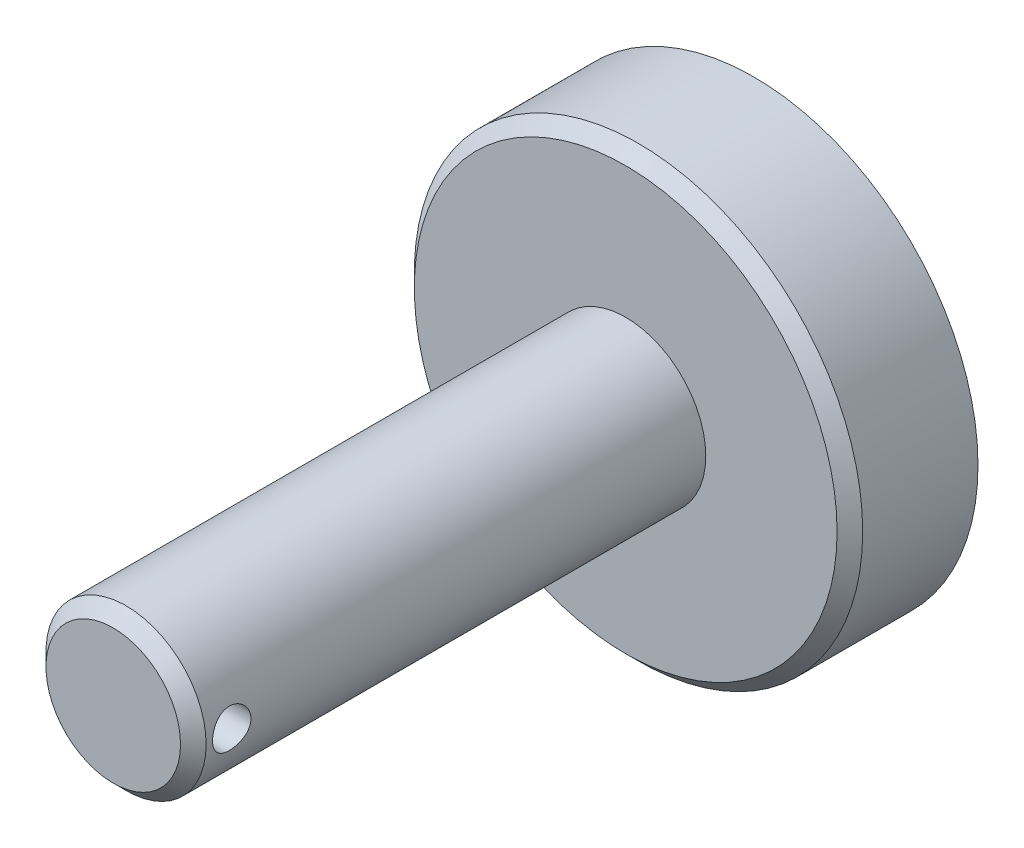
SolidWorks part; units mm, degrees
ref_plane "Face" through (0, 0, 0) normal (0, 0, 1) x (1, 0, 0)
ref_plane "Dessus" through (0, 0, 0) normal (0, 1, 0) x (1, 0, 0)
ref_plane "Droite" through (0, 0, 0) normal (1, 0, 0) x (0, 0, -1)
sketch "Esquisse1" plane through (0, 0, 0) normal (0, 0, 1) x (1, 0, 0)
  circle A0 centre (0, 0) radius 35
  dimension "D1" = 70
extrude "Base-Extrusion" add sketch "Esquisse1" along normal blind 20
sketch "Esquisse2" plane through (0, 0, 20) normal (0, 0, 1) x (1, 0, 0)
  circle A0 centre (0, 0) radius 12.5
  dimension "D1" = 25
extrude "Boss.-Extru.1" add sketch "Esquisse2" along normal blind 80
chamfer "Chanfrein1" distance 2 angle 45
sketch "Esquisse3" plane through (0, 0, 0) normal (1, 0, 0) x (0, 0, -1)
  line L0 (-18, 0) -> (0, 0) construction
  line L1 (-100, 10.5) -> (-100, -10.5) construction
  circle A0 centre (-94, 0) radius 3
  dimension "D1" = 6
  dimension "D2" = 6
extrude "Enlèv. mat.-Extru.1" cut sketch "Esquisse3" against normal mid plane 30
